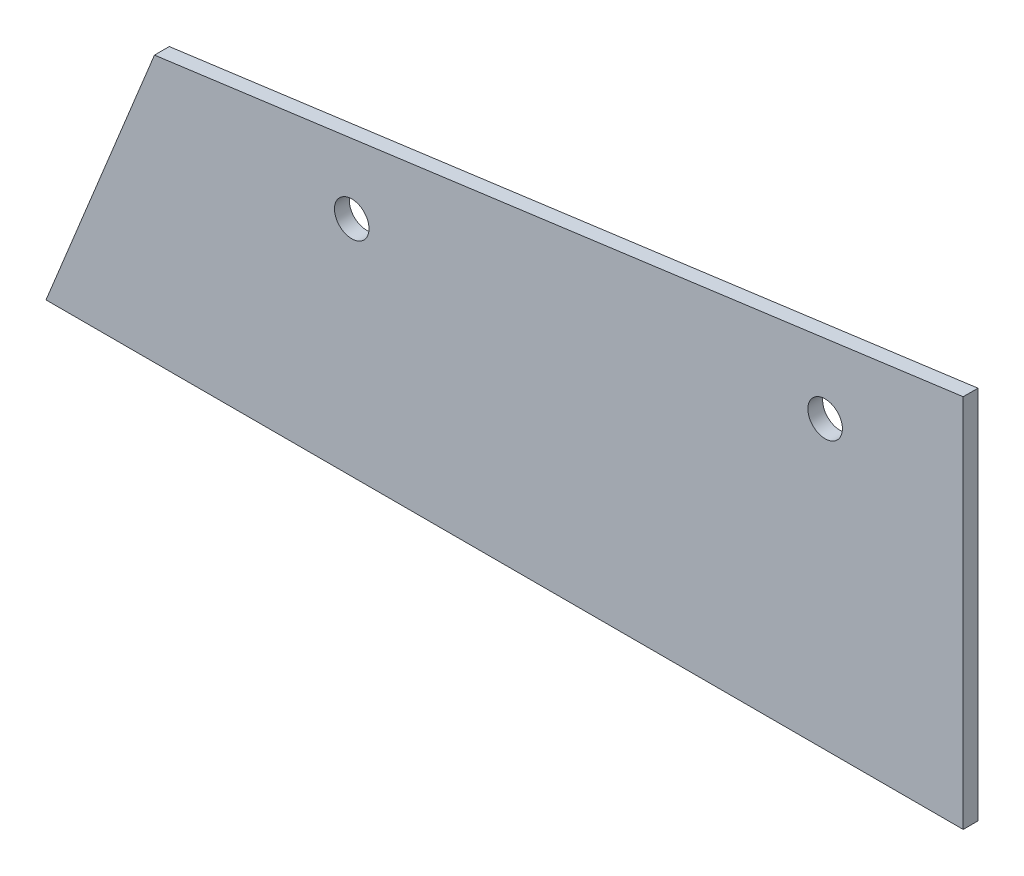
SolidWorks part; units mm, degrees
ref_plane "Front Plane" through (0, 0, 0) normal (0, 0, 1) x (1, 0, 0)
ref_plane "Top Plane" through (0, 0, 0) normal (0, 1, 0) x (1, 0, 0)
ref_plane "Right Plane" through (0, 0, 0) normal (1, 0, 0) x (0, 0, -1)
sketch "Sketch1" plane through (0, 0, 0) normal (0, 0, 1) x (1, 0, 0)
  line L0 (0, 0) -> (93, 0)
  line L1 (93, 0) -> (93, 38)
  line L2 (93, 38) -> (11, 27)
  line L3 (11, 27) -> (0, 0)
  line L4 (31, 22.6202) -> (79, 29.0592) construction
  circle A0 centre (79, 29.0592) radius 1.75
  circle A1 centre (31, 22.6202) radius 1.75
  dimension "D5" = 3.5
  dimension "D6" = 14
  dimension "D7" = 48
  dimension "D8" = 20
  dimension "D1" = 27
  dimension "D2" = 7
  dimension "D3" = 93
  dimension "D4" = 38
extrude "Extrude1" add sketch "Sketch1" along normal blind 1.5
